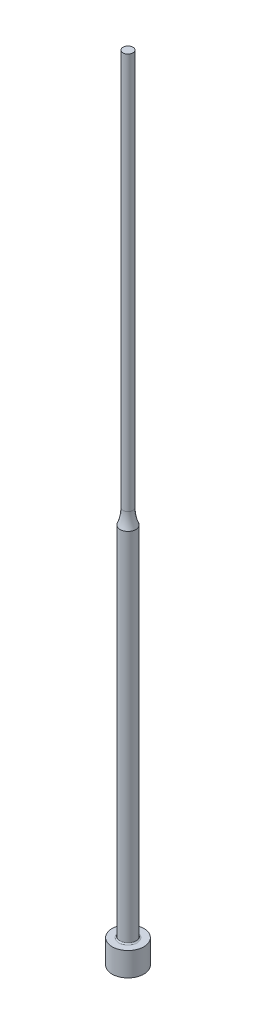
SolidWorks part; units mm, degrees
ref_plane "Front Plane" through (0, 0, 0) normal (0, 0, 1) x (1, 0, 0)
ref_plane "Top Plane" through (0, 0, 0) normal (0, 1, 0) x (1, 0, 0)
ref_plane "Right Plane" through (0, 0, 0) normal (1, 0, 0) x (0, 0, -1)
sketch "Sketch1" plane through (0, 0, 0) normal (0, 0, 1) x (1, 0, 0)
  line L0 (0, 0) -> (4, 0)
  line L1 (55, 0) -> (-55, 0) construction
  line L2 (4, 0) -> (4, 6)
  line L3 (4, 6) -> (2.3, 6)
  line L4 (2, 6.3) -> (2, 96.2003)
  line L6 (1.25, 100) -> (1.25, 200)
  line L7 (1.25, 200) -> (0, 200)
  line L8 (0, 200) -> (0, 0)
  arc A0 (1.25, 100) -> (2, 96.2003) centre (11.25, 100) ccw
  arc A1 (2.3, 6) -> (2, 6.3) centre (2.3, 6.3) cw
  dimension "D7" = 100
  dimension "D8" = 0.3
  dimension "D5" = 10
  dimension "D1" = 1.25
  dimension "D2" = 2
  dimension "D3" = 4
  dimension "D4" = 6
  dimension "D6" = 200
revolve "Revolve1" add sketch "Sketch1" angle 360 about L8
